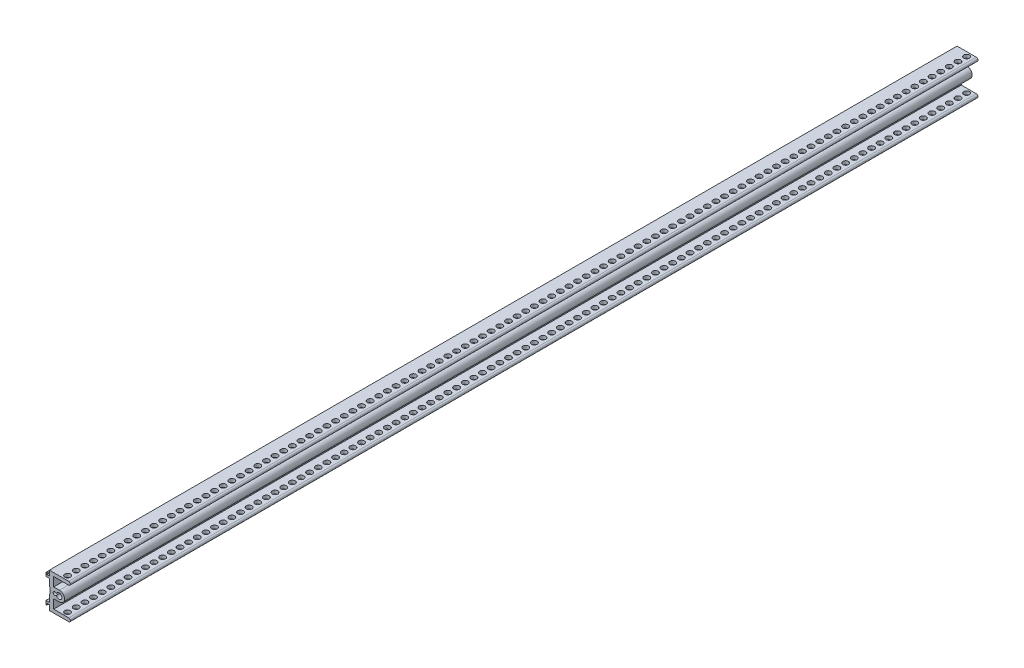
SolidWorks part; units mm, degrees
ref_plane "前视基准面" through (0, 0, 0) normal (0, 0, 1) x (1, 0, 0)
ref_plane "上视基准面" through (0, 0, 0) normal (0, 1, 0) x (1, 0, 0)
ref_plane "右视基准面" through (0, 0, 0) normal (1, 0, 0) x (0, 0, -1)
sketch "草图1" plane through (0, 0, 0) normal (0, 0, 1) x (1, 0, 0)
  line L0 (-4.15, 8.3) -> (-4.15, 3)
  line L1 (-6.65, 10.3) -> (4.65, 10.3)
  line L2 (-6.65, 7.3) -> (-8.05, 7.3)
  line L3 (4.65, 8.3) -> (-4.15, 8.3)
  line L4 (-6.65, -6.1) -> (-6.65, -2.0884)
  line L5 (-6.65, 2.1116) -> (-6.35, 1.5116)
  line L6 (-0.75, 0) -> (3.3598, 0) construction
  line L7 (-6.65, -7.3) -> (-6.65, -10.3)
  line L8 (-8.65, -8.0782) -> (-8.65, -6.1)
  line L9 (-6.65, -6.1) -> (-8.65, -6.1)
  line L10 (-8.05, -8.0782) -> (-8.05, -7.3)
  line L11 (-6.65, -2.0884) -> (-6.35, -1.4884)
  line L12 (-6.65, 2.1116) -> (-6.65, 6.1)
  line L13 (4.65, -8.3) -> (-4.15, -8.3)
  line L14 (-6.65, -10.3) -> (4.65, -10.3)
  line L15 (-4.15, -8.3) -> (-4.15, -3)
  line L16 (-6.35, 1.5116) -> (-6.35, -1.4884)
  line L17 (-4.15, 3) -> (-0.75, 3)
  line L18 (-8.05, 8.0782) -> (-8.05, 7.3)
  line L19 (-0.75, -3) -> (-4.15, -3)
  line L20 (-6.65, 6.1) -> (-8.65, 6.1)
  line L21 (-8.65, 8.0782) -> (-8.65, 6.1)
  line L22 (-6.65, -7.3) -> (-8.05, -7.3)
  line L23 (-8.35, -8.3782) -> (-9.7583, -8.3782) construction
  line L24 (-8.35, 8.3782) -> (-9.5309, 8.3782) construction
  line L25 (-6.65, 7.3) -> (-6.65, 10.3)
  arc A0 (-8.65, 8.0782) -> (-8.05, 8.0782) centre (-8.35, 8.0782) cw
  arc A4 (4.65, -8.3) -> (4.65, -10.3) centre (4.65, -9.3) cw
  arc A6 (-8.65, -8.0782) -> (-8.05, -8.0782) centre (-8.35, -8.0782) ccw
  arc A8 (4.65, 8.3) -> (4.65, 10.3) centre (4.65, 9.3) ccw
  arc A10 (-0.75, 3) -> (-0.75, -3) centre (-0.75, 0) cw
  arc A11 (-2.5445, -0.4243) -> (-2.5445, 0.4243) centre (-0.95, 0) ccw
  arc A12 (-2.5445, 0.4243) -> (-2.5445, -0.4243) centre (-3.45, 0) ccw
  dimension "D4" = 1.4
  dimension "D12" = 16.7565
  dimension "D3" = 0.3
  dimension "D8" = 7.7
  dimension "D5" = 2
  dimension "D6" = 0.3
  dimension "D7" = 2
  dimension "D11" = 1
  dimension "D1" = 1.2
  dimension "D2" = 3
  dimension "D9" = 13.3
  dimension "D10" = 13.3
extrude "凸台-拉伸1" add sketch "草图1" along normal mid plane 533.4
sketch "草图3" plane through (0, -10.3, 0) normal (0, -1, 0) x (1, 0, 0)
  line L0 (-6.65, 266.7) -> (4.65, 266.7) construction
  line L2 (4.65, 266.7) -> (4.65, -266.7) construction
  circle A0 centre (1.5, 264.16) radius 1.65
  circle A1 centre (1.5, 259.08) radius 1.65
  circle A2 centre (1.5, 254) radius 1.65
  circle A3 centre (1.5, 248.92) radius 1.65
  circle A4 centre (1.5, 243.84) radius 1.65
  circle A5 centre (1.5, 238.76) radius 1.65
  circle A6 centre (1.5, 233.68) radius 1.65
  circle A7 centre (1.5, 228.6) radius 1.65
  circle A8 centre (1.5, 223.52) radius 1.65
  circle A9 centre (1.5, 218.44) radius 1.65
  circle A10 centre (1.5, 213.36) radius 1.65
  circle A11 centre (1.5, 208.28) radius 1.65
  circle A12 centre (1.5, 203.2) radius 1.65
  circle A13 centre (1.5, 198.12) radius 1.65
  circle A14 centre (1.5, 193.04) radius 1.65
  circle A15 centre (1.5, 187.96) radius 1.65
  circle A16 centre (1.5, 182.88) radius 1.65
  circle A17 centre (1.5, 177.8) radius 1.65
  circle A18 centre (1.5, 172.72) radius 1.65
  circle A19 centre (1.5, 167.64) radius 1.65
  circle A20 centre (1.5, 162.56) radius 1.65
  circle A21 centre (1.5, 157.48) radius 1.65
  circle A22 centre (1.5, 152.4) radius 1.65
  circle A23 centre (1.5, 147.32) radius 1.65
  circle A24 centre (1.5, 142.24) radius 1.65
  circle A25 centre (1.5, 137.16) radius 1.65
  circle A26 centre (1.5, 132.08) radius 1.65
  circle A27 centre (1.5, 127) radius 1.65
  circle A28 centre (1.5, 121.92) radius 1.65
  circle A29 centre (1.5, 116.84) radius 1.65
  circle A30 centre (1.5, 111.76) radius 1.65
  circle A31 centre (1.5, 106.68) radius 1.65
  circle A32 centre (1.5, 101.6) radius 1.65
  circle A33 centre (1.5, 96.52) radius 1.65
  circle A34 centre (1.5, 91.44) radius 1.65
  circle A35 centre (1.5, 86.36) radius 1.65
  circle A36 centre (1.5, 81.28) radius 1.65
  circle A37 centre (1.5, 76.2) radius 1.65
  circle A38 centre (1.5, 71.12) radius 1.65
  circle A39 centre (1.5, 66.04) radius 1.65
  circle A40 centre (1.5, 60.96) radius 1.65
  circle A41 centre (1.5, 55.88) radius 1.65
  circle A42 centre (1.5, 50.8) radius 1.65
  circle A43 centre (1.5, 45.72) radius 1.65
  circle A44 centre (1.5, 40.64) radius 1.65
  circle A45 centre (1.5, 35.56) radius 1.65
  circle A46 centre (1.5, 30.48) radius 1.65
  circle A47 centre (1.5, 25.4) radius 1.65
  circle A48 centre (1.5, 20.32) radius 1.65
  circle A49 centre (1.5, 15.24) radius 1.65
  circle A50 centre (1.5, 10.16) radius 1.65
  circle A51 centre (1.5, 5.08) radius 1.65
  circle A52 centre (1.5, 0) radius 1.65
  circle A53 centre (1.5, -5.08) radius 1.65
  circle A54 centre (1.5, -10.16) radius 1.65
  circle A55 centre (1.5, -15.24) radius 1.65
  circle A56 centre (1.5, -20.32) radius 1.65
  circle A57 centre (1.5, -25.4) radius 1.65
  circle A58 centre (1.5, -30.48) radius 1.65
  circle A59 centre (1.5, -35.56) radius 1.65
  circle A60 centre (1.5, -40.64) radius 1.65
  circle A61 centre (1.5, -45.72) radius 1.65
  circle A62 centre (1.5, -50.8) radius 1.65
  circle A63 centre (1.5, -55.88) radius 1.65
  circle A64 centre (1.5, -60.96) radius 1.65
  circle A65 centre (1.5, -66.04) radius 1.65
  circle A66 centre (1.5, -71.12) radius 1.65
  circle A67 centre (1.5, -76.2) radius 1.65
  circle A68 centre (1.5, -81.28) radius 1.65
  circle A69 centre (1.5, -86.36) radius 1.65
  circle A70 centre (1.5, -91.44) radius 1.65
  circle A71 centre (1.5, -96.52) radius 1.65
  circle A72 centre (1.5, -101.6) radius 1.65
  circle A73 centre (1.5, -106.68) radius 1.65
  circle A74 centre (1.5, -111.76) radius 1.65
  circle A75 centre (1.5, -116.84) radius 1.65
  circle A76 centre (1.5, -121.92) radius 1.65
  circle A77 centre (1.5, -127) radius 1.65
  circle A78 centre (1.5, -132.08) radius 1.65
  circle A79 centre (1.5, -137.16) radius 1.65
  circle A80 centre (1.5, -142.24) radius 1.65
  circle A81 centre (1.5, -147.32) radius 1.65
  circle A82 centre (1.5, -152.4) radius 1.65
  circle A83 centre (1.5, -157.48) radius 1.65
  circle A84 centre (1.5, -162.56) radius 1.65
  circle A85 centre (1.5, -167.64) radius 1.65
  circle A86 centre (1.5, -172.72) radius 1.65
  circle A87 centre (1.5, -177.8) radius 1.65
  circle A88 centre (1.5, -182.88) radius 1.65
  circle A89 centre (1.5, -187.96) radius 1.65
  circle A90 centre (1.5, -193.04) radius 1.65
  circle A91 centre (1.5, -198.12) radius 1.65
  circle A92 centre (1.5, -203.2) radius 1.65
  circle A93 centre (1.5, -208.28) radius 1.65
  circle A94 centre (1.5, -213.36) radius 1.65
  circle A95 centre (1.5, -218.44) radius 1.65
  circle A96 centre (1.5, -223.52) radius 1.65
  circle A97 centre (1.5, -228.6) radius 1.65
  circle A98 centre (1.5, -233.68) radius 1.65
  circle A99 centre (1.5, -238.76) radius 1.65
  circle A100 centre (1.5, -243.84) radius 1.65
  circle A101 centre (1.5, -248.92) radius 1.65
  circle A102 centre (1.5, -254) radius 1.65
  circle A103 centre (1.5, -259.08) radius 1.65
  circle A104 centre (1.5, -264.16) radius 1.65
  dimension "D1" = 3.3
  dimension "D2" = 3.15
  dimension "D4" = 105
  dimension "D3" = 2.54
extrude "切除-拉伸1" cut sketch "草图3" against normal blind 2.5
mirror "镜向1" about plane through (0, 0, 0) normal (0, 1, 0) of "切除-拉伸1"
